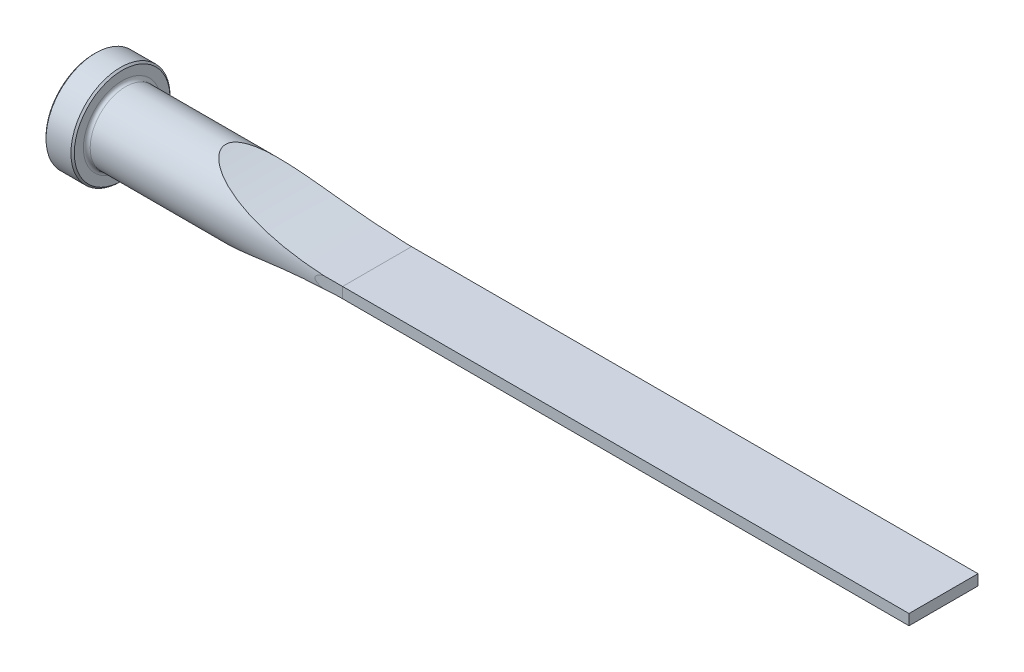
SolidWorks part; units mm, degrees
ref_plane "Front Plane" through (0, 0, 0) normal (0, 0, 1) x (1, 0, 0)
ref_plane "Top Plane" through (0, 0, 0) normal (0, 1, 0) x (1, 0, 0)
ref_plane "Right Plane" through (0, 0, 0) normal (1, 0, 0) x (0, 0, -1)
sketch "Sketch1" plane through (0, 0, 0) normal (0, 0, 1) x (1, 0, 0)
  line L0 (0, 0) -> (175.5286, 0) construction
  line L1 (0, 0) -> (0, 11.1125)
  line L2 (0, 11.1125) -> (6.35, 11.1125)
  line L3 (6.35, 11.1125) -> (6.35, 7.9375)
  line L4 (6.35, 7.9375) -> (190.5, 7.9375)
  line L5 (190.5, 7.9375) -> (190.5, 0)
  line L6 (190.5, 0) -> (0, 0)
  dimension "D1" = 190.5
  dimension "D2" = 22.225
  dimension "D3" = 15.875
  dimension "D4" = 6.35
revolve "Revolve1" add sketch "Sketch1" angle 360 about L0
sketch "Sketch2" plane through (0, 0, 0) normal (0, 0, 1) x (1, 0, 0)
  line L0 (190.5, 7.9375) -> (190.5, 1.1938)
  line L1 (190.5, -7.9375) -> (190.5, 7.9375) construction
  line L2 (190.5, 1.1938) -> (63.5, 1.1938)
  line L3 (190.5, 7.9375) -> (6.35, 7.9375) construction
  line L4 (29.536, 7.9375) -> (190.5, 7.9375)
  line L5 (166.0833, 0) -> (153.1705, 0) construction
  arc A0 (63.5, 1.1938) -> (29.536, 7.9375) centre (63.5, 90.0938) cw
  dimension "D1" = 88.9
  dimension "D3" = 127
  dimension "D2" = 2.3876
  dimension "D4" = 33.964
extrude "Cut-Extrude1" cut sketch "Sketch2" against normal through all both and the other way through all
mirror "Mirror1" about plane through (0, 0, 0) normal (0, 1, 0) of "Cut-Extrude1"
sketch "Sketch3" plane through (0, 0, 0) normal (0, 1, 0) x (1, 0, 0)
  line L0 (190.5, 7.9375) -> (190.5, 7.7343)
  line L1 (190.5, 7.8472) -> (190.5, -7.8472) construction
  line L2 (190.5, 7.7343) -> (63.5, 7.7343)
  line L3 (190.5, 7.9375) -> (6.35, 7.9375) construction
  line L4 (57.4927, 7.9375) -> (190.5, 7.9375)
  line L5 (163.4716, 0) -> (166.2513, 0) construction
  line L6 (63.5, 7.8472) -> (63.5, -7.8472) construction
  arc A0 (63.5, 7.7343) -> (57.4927, 7.9375) centre (63.5, 96.6343) cw
  dimension "D2" = 88.9
  dimension "D1" = 15.4686
extrude "Cut-Extrude2" cut sketch "Sketch3" against normal through all both and the other way through all
mirror "Mirror2" about plane through (0, 0, 0) normal (0, 0, 1) of "Cut-Extrude2"
fillet "Fillet1" radius 0.762 1 edges at (6.35, 0, 7.9375)
chamfer "Chamfer1" distance 0.381 angle 45 2 edges at (0, 0, 11.1125) (6.35, 0, 11.1125)
